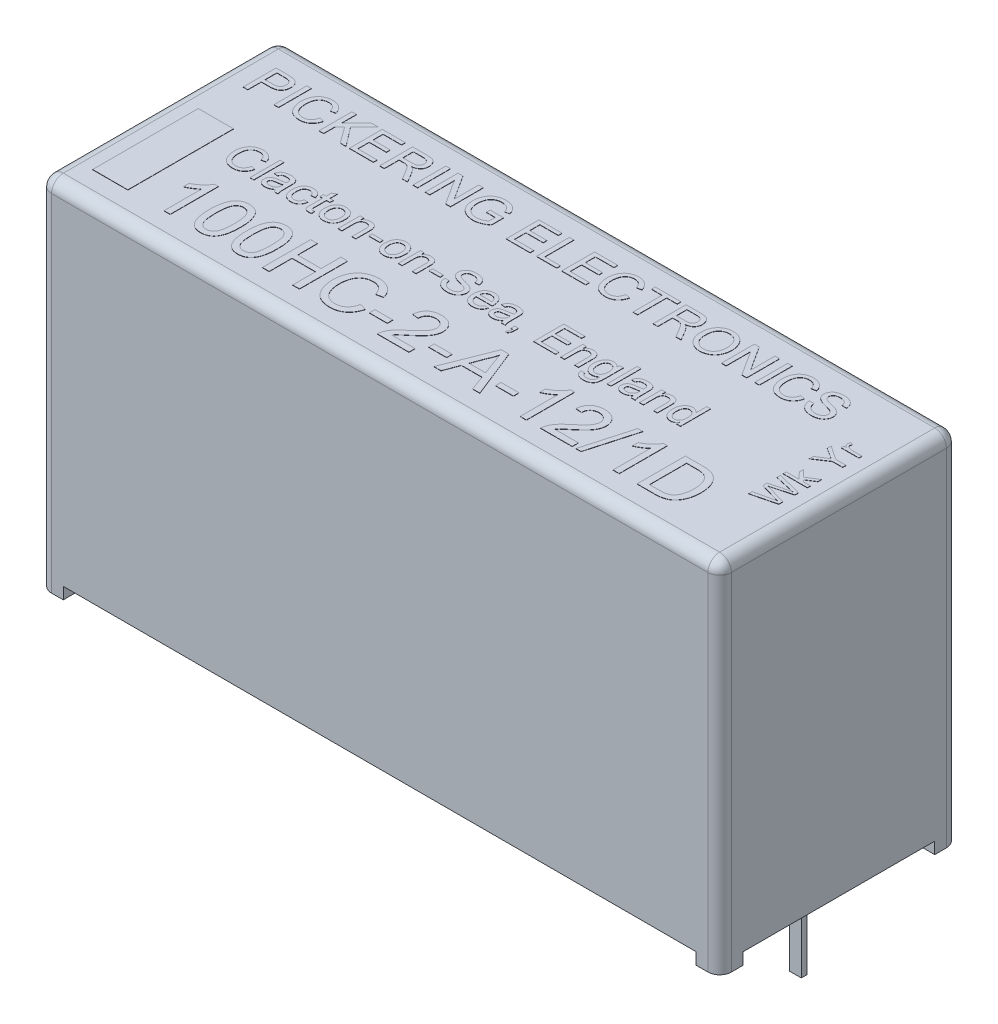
SolidWorks part; units mm, degrees
ref_plane "Front Plane" through (0, 0, 0) normal (0, 0, 1) x (1, 0, 0)
ref_plane "Top Plane" through (0, 0, 0) normal (0, 1, 0) x (1, 0, 0)
ref_plane "Right Plane" through (0, 0, 0) normal (1, 0, 0) x (0, 0, -1)
sketch "Sketch1" plane through (0, 0, 0) normal (0, 1, 0) x (1, 0, 0)
  line L1 (-14.478, -5.08) -> (14.478, -5.08)
  line L2 (-14.478, -5.08) -> (-14.478, 5.08)
  line L3 (-14.478, 5.08) -> (14.478, 5.08)
  line L4 (14.478, -5.08) -> (14.478, 5.08)
  line L5 (-14.478, -5.08) -> (14.478, 5.08) construction
  line L6 (-14.478, 5.08) -> (14.478, -5.08) construction
  point P0 (0, 0)
  dimension "D1" = 28.956
  dimension "D2" = 10.16
extrude "Boss-Extrude1" add sketch "Sketch1" along normal blind 15.24
sketch "Sketch2" plane through (0, 0, 5.08) normal (0, 0, 1) x (1, 0, 0)
  line L0 (-14.478, 0) -> (14.478, 0) construction
  line L1 (-13.478, 0) -> (13.478, 0)
  line L2 (-13.478, 0) -> (-13.478, 0.5)
  line L3 (-13.478, 0.5) -> (13.478, 0.5)
  line L4 (13.478, 0) -> (13.478, 0.5)
  line L5 (-14.478, 15.24) -> (-14.478, 0) construction
  line L6 (14.478, 15.24) -> (14.478, 0) construction
  dimension "D1" = 1
  dimension "D2" = 1
  dimension "D3" = 0.5
extrude "Cut-Extrude1" cut sketch "Sketch2" against normal through all
sketch "Sketch3" plane through (14.478, 0, 0) normal (1, 0, 0) x (0, 0, -1)
  line L0 (-5.08, 0) -> (5.08, 0) construction
  line L1 (-4.08, 0) -> (4.08, 0)
  line L2 (-4.08, 0) -> (-4.08, 0.5)
  line L3 (-4.08, 0.5) -> (4.08, 0.5)
  line L4 (4.08, 0) -> (4.08, 0.5)
  line L5 (-5.08, 15.24) -> (-5.08, 0) construction
  line L6 (5.08, 15.24) -> (5.08, 0) construction
  dimension "D1" = 1
  dimension "D2" = 1
  dimension "D3" = 0.5
extrude "Cut-Extrude2" cut sketch "Sketch3" against normal through all
sketch "Sketch4" plane through (0, 0.5, 0) normal (0, -1, 0) x (1, 0, 0)
  line L0 (-14.478, 0) -> (14.478, 0) construction
  line L1 (-14.478, -4.08) -> (-14.478, 4.08) construction
  line L2 (14.478, -4.08) -> (14.478, 4.08) construction
  line L4 (13.478, 5.08) -> (-13.478, 5.08) construction
  line L5 (0, 5.08) -> (0, -5.08) construction
  line L6 (13.478, -5.08) -> (-13.478, -5.08) construction
  line L7 (-2.8, -0.125) -> (-2.3, -0.125)
  line L8 (-2.8, -0.125) -> (-2.8, 0.125)
  line L9 (-2.8, 0.125) -> (-2.3, 0.125)
  line L10 (-2.3, -0.125) -> (-2.3, 0.125)
  line L11 (-2.8, -0.125) -> (-2.3, 0.125) construction
  line L12 (-2.8, 0.125) -> (-2.3, -0.125) construction
  line L13 (-7.9, -0.125) -> (-7.4, -0.125)
  line L14 (-7.9, -0.125) -> (-7.9, 0.125)
  line L15 (-7.9, 0.125) -> (-7.4, 0.125)
  line L16 (-7.4, -0.125) -> (-7.4, 0.125)
  line L17 (-7.9, -0.125) -> (-7.4, 0.125) construction
  line L18 (-7.9, 0.125) -> (-7.4, -0.125) construction
  line L19 (2.3, -0.125) -> (2.8, -0.125)
  line L20 (2.3, -0.125) -> (2.3, 0.125)
  line L21 (2.3, 0.125) -> (2.8, 0.125)
  line L22 (2.8, -0.125) -> (2.8, 0.125)
  line L23 (2.3, -0.125) -> (2.8, 0.125) construction
  line L24 (2.3, 0.125) -> (2.8, -0.125) construction
  line L25 (7.4, -0.125) -> (7.9, -0.125)
  line L26 (7.4, -0.125) -> (7.4, 0.125)
  line L27 (7.4, 0.125) -> (7.9, 0.125)
  line L28 (7.9, -0.125) -> (7.9, 0.125)
  line L29 (7.4, -0.125) -> (7.9, 0.125) construction
  line L30 (7.4, 0.125) -> (7.9, -0.125) construction
  line L31 (12.5, -0.125) -> (13, -0.125)
  line L32 (12.5, -0.125) -> (12.5, 0.125)
  line L33 (12.5, 0.125) -> (13, 0.125)
  line L34 (13, -0.125) -> (13, 0.125)
  line L35 (12.5, -0.125) -> (13, 0.125) construction
  line L36 (12.5, 0.125) -> (13, -0.125) construction
  line L37 (-13, -0.125) -> (-12.5, -0.125)
  line L38 (-13, -0.125) -> (-13, 0.125)
  line L39 (-13, 0.125) -> (-12.5, 0.125)
  line L40 (-12.5, -0.125) -> (-12.5, 0.125)
  line L41 (-13, -0.125) -> (-12.5, 0.125) construction
  line L42 (-13, 0.125) -> (-12.5, -0.125) construction
  point P6 (-2.55, 0)
  point P17 (-7.65, 0)
  point P22 (2.55, 0)
  point P27 (7.65, 0)
  point P32 (12.75, 0)
  point P37 (-12.75, 0)
  dimension "D1" = 5.1
  dimension "D2" = 5.1
  dimension "D3" = 5.1
  dimension "D4" = 0.5
  dimension "D5" = 0.25
  dimension "D6" = 5.1
  dimension "D7" = 5.1
extrude "Boss-Extrude2" add sketch "Sketch4" along normal blind 3.6854 separate body
fillet "Fillet2" radius 0.5 4 edges at (0, 15.24, 5.08) (-14.478, 15.24, 0) (0, 15.24, -5.08) (14.478, 15.24, 0)
fillet "Fillet3" radius 0.5 8 edges at (-14.3316, 15.0936, -4.9336) (14.3316, 15.0936, -4.9336) (14.3316, 15.0936, 4.9336) (-14.3316, 15.0936, 4.9336) (-14.478, 7.37, -5.08) (14.478, 7.37, -5.08) (14.478, 7.37, 5.08) (-14.478, 7.37, 5.08)
sketch "Sketch5" plane through (0, 15.24, 0) normal (0, 1, 0) x (1, 0, 0)
  line L0 (-13.478, 2.42) -> (10.7486, 2.42) construction
  line L1 (-11.228, -0.78) -> (8.6555, -0.78) construction
  line L2 (-11.228, -3.83) -> (12.0348, -3.83) construction
  line L3 (13.978, -5.08) -> (-13.978, -5.08) construction
  line L4 (-13.478, 0.67) -> (-11.978, 0.67)
  line L5 (-13.478, 0.67) -> (-13.478, -3.83)
  line L6 (-13.478, -3.83) -> (-11.978, -3.83)
  line L7 (-11.978, 0.67) -> (-11.978, -3.83)
  line L8 (-14.478, -4.58) -> (-14.478, 4.58) construction
  line L9 (13.478, -1.83) -> (13.478, 2.742) construction
  line L10 (14.478, 4.58) -> (14.478, -4.58) construction
  text T0 "PICKERING ELECTRONICS" font "Arial" height 1.4
  text T1 "Clacton-on-Sea, England" font "Arial" height in points 5
  text T2 "100HC-2-A-12/1D" font "Arial" height in points 8
  text T3 "Wk Yr" font "Arial" height in points 4
  dimension "D1" = 4.5
  dimension "D2" = 1.5
  dimension "D3" = 1.25
  dimension "D4" = 1
  dimension "D5" = 1.25
  dimension "D6" = 4.3
  dimension "D7" = 7.5
  dimension "D8" = 3.25
  dimension "D9" = 3.25
  dimension "D10" = 3.25
  dimension "D11" = 1
extrude "Print Details" add sketch "Sketch5" along normal blind 0.01 separate body
equation "\"1.251.20mm\"=1.2"
